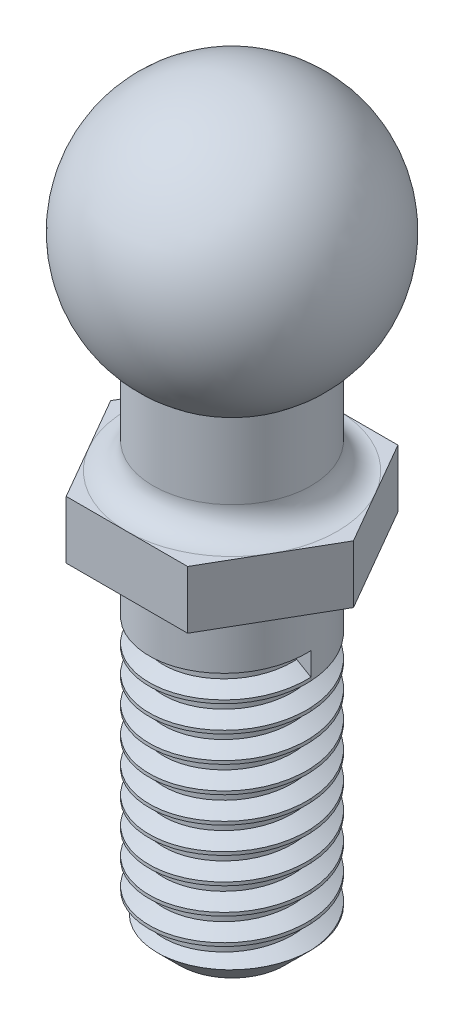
SolidWorks part; units mm, degrees
ref_plane "Plan de face" through (0, 0, 0) normal (0, 0, 1) x (1, 0, 0)
ref_plane "Plan de dessus" through (0, 0, 0) normal (0, 1, 0) x (1, 0, 0)
ref_plane "Plan de droite" through (0, 0, 0) normal (1, 0, 0) x (0, 0, -1)
sketch "Esquisse1" plane through (0, 0, 0) normal (0, 0, 1) x (1, 0, 0)
  line L0 (0, 34.3479) -> (0, -13.7179) construction
  line L1 (3, 19.17) -> (3, 0)
  line L2 (3, 0) -> (0, 0)
  line L3 (0, 28.17) -> (0, 0)
  arc A0 (0, 28.17) -> (3, 19.17) centre (0, 23.17) cw
  dimension "D1" = 5
  dimension "D2" = 3
  dimension "D3" = 19.17
revolve "Révolution1" add sketch "Esquisse1" angle 360 about L0
ref_plane "Plan1" through (0, 13.1, 0) normal (0, -1, 0) x (-1, 0, 0)
sketch "Esquisse2" plane through (0, 13.1, 0) normal (0, -1, 0) x (-1, 0, 0)
  line L1 (2.3094, -4) -> (4.6188, 0)
  line L2 (4.6188, 0) -> (2.3094, 4)
  line L3 (2.3094, 4) -> (-2.3094, 4)
  line L4 (-2.3094, 4) -> (-4.6188, 0)
  line L5 (-4.6188, 0) -> (-2.3094, -4)
  line L6 (-2.3094, -4) -> (2.3094, -4)
  circle A0 centre (0, 0) radius 4 construction
  dimension "D1" = 8
extrude "Boss.-Extru.1" add sketch "Esquisse2" against normal blind 2.2
fillet "Congé1" radius 1 1 edges at (0, 15.3, -3)
chamfer "Chanfrein1" distance 1 angle 45 1 edges at (0, 0, 3)
thread "M6-12,5" pitch 1 start angle 0, offset 0, length 10, pitch 1, diameter 6
ref_plane "Plan4" through (3, 0, 0) normal (0, 0, 1) x (1, 0, 0)
sketch "Profil de filetage3" plane through (3, 0, 0) normal (0, 0, 1) x (1, 0, 0)
  line L0 (0, 0) -> (0, 1) construction
  line L11 (0, 0) -> (0, 0.875)
  line L12 (0, 0.875) -> (-0.5413, 0.5625)
  line L13 (-0.5413, 0.5625) -> (-0.5413, 0.3125)
  line L15 (-0.5413, 0.3125) -> (0, 0)
  line L17 (-0.5413, 0.4375) -> (0, 0.4375) construction
  point P2 (0, 0)
  dimension "Pitch" = 1
  dimension "Profile_Angle" = 60
  dimension "Profile_Land" = 0.25
  dimension "Profile_Height" = 0.5413
ref_point "centre rotule"
